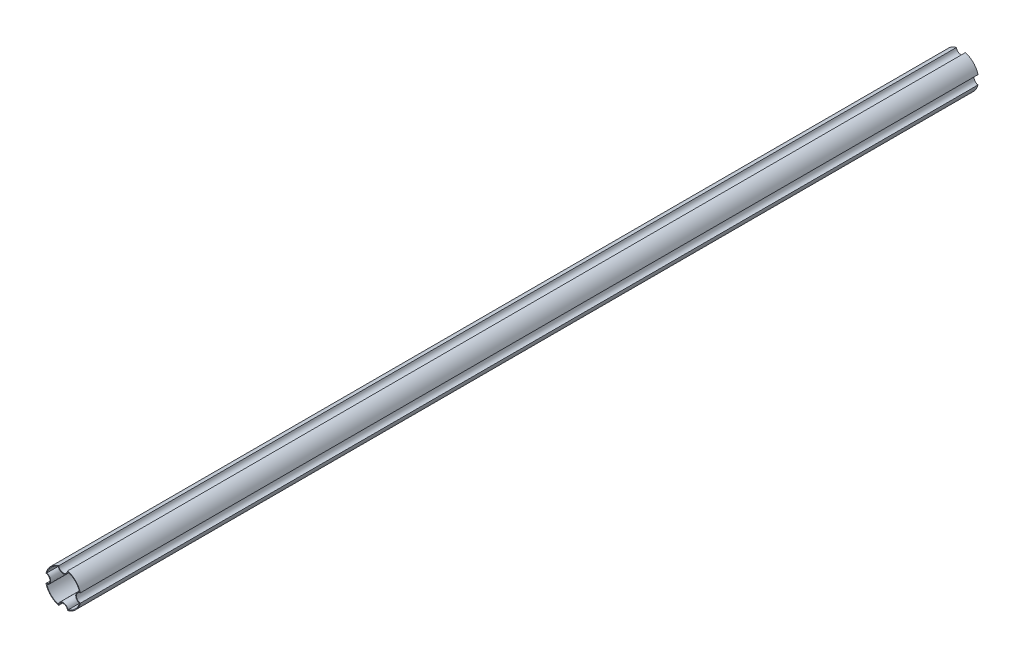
SolidWorks part; units mm, degrees
ref_plane "Plan de face" through (0, 0, 0) normal (0, 0, 1) x (1, 0, 0)
ref_plane "Plan de dessus" through (0, 0, 0) normal (0, 1, 0) x (1, 0, 0)
ref_plane "Plan de droite" through (0, 0, 0) normal (1, 0, 0) x (0, 0, -1)
sketch "Esquisse1" plane through (0, 0, 0) normal (0, 0, 1) x (1, 0, 0)
  arc A4 (9.9196, -38.2342) -> (-9.9196, -38.2342) centre (0, -39.5) ccw
  arc A5 (2.9625, -39.3887) -> (2.9625, 39.3887) centre (0, 0) ccw
  arc A6 (9.9196, -38.2342) -> (38.2342, -9.9196) centre (0, 0) ccw
  arc A7 (-38.2342, -9.9196) -> (-38.2342, 9.9196) centre (-39.5, 0) ccw
  arc A8 (-9.9196, 38.2342) -> (9.9196, 38.2342) centre (0, 39.5) ccw
  arc A9 (38.2342, 9.9196) -> (38.2342, -9.9196) centre (39.5, 0) ccw
  arc A10 (38.2342, 9.9196) -> (9.9196, 38.2342) centre (0, 0) ccw
  arc A11 (-9.9196, 38.2342) -> (-38.2342, 9.9196) centre (0, 0) ccw
  arc A12 (-38.2342, -9.9196) -> (-9.9196, -38.2342) centre (0, 0) ccw
  dimension "D2" = 20
  dimension "D1" = 0.5
extrude "Extru.-Mince1" add sketch "Esquisse1" against normal blind 2000 thin
